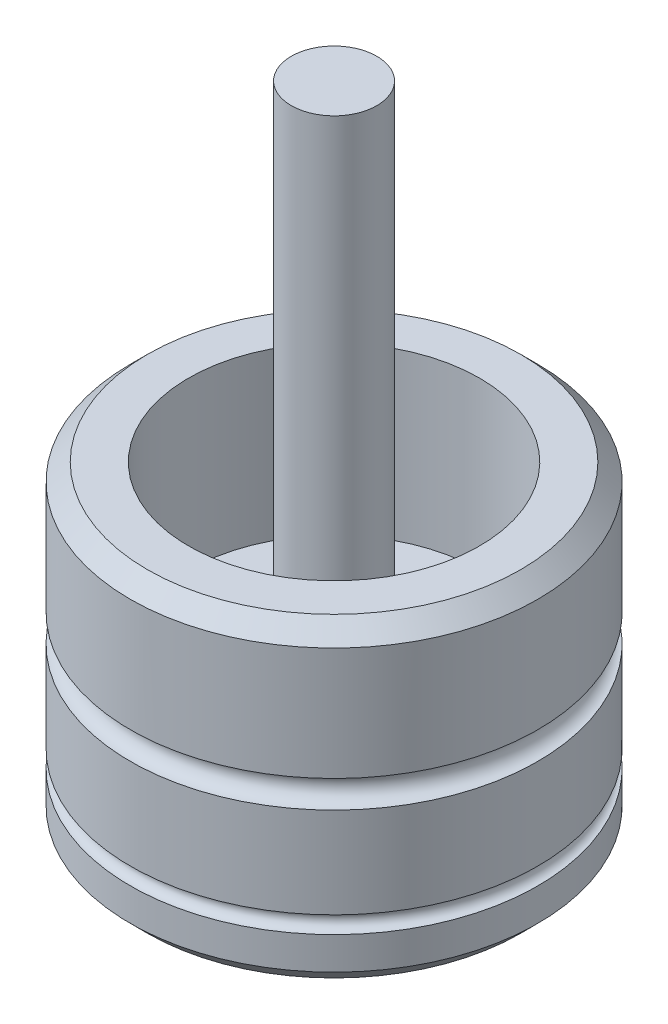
SolidWorks part; units mm, degrees
ref_plane "Front Plane" through (0, 0, 0) normal (0, 0, 1) x (1, 0, 0)
ref_plane "Top Plane" through (0, 0, 0) normal (0, 1, 0) x (1, 0, 0)
ref_plane "Right Plane" through (0, 0, 0) normal (1, 0, 0) x (0, 0, -1)
sketch "Sketch1" plane through (0, 0, 0) normal (1, 0, 0) x (0, 0, -1)
  line L0 (0, 0) -> (0, 92.5938) construction
  line L1 (0, 0) -> (15.113, 0)
  line L2 (15.113, 0) -> (15.113, 3.683)
  line L3 (15.113, 23.368) -> (10.795, 23.368)
  line L4 (10.795, 23.368) -> (10.795, 11.0265)
  line L5 (10.795, 11.0265) -> (0, 11.0265)
  line L6 (0, 11.0265) -> (0, 0)
  line L7 (15.113, 4.953) -> (15.113, 11.684)
  line L8 (15.113, 13.716) -> (15.113, 23.368)
  arc A0 (15.113, 4.953) -> (15.113, 3.683) centre (15.113, 4.318) ccw
  arc A1 (15.113, 13.716) -> (15.113, 11.684) centre (15.113, 12.7) ccw
  dimension "D5" = 4.318
  dimension "D7" = 1.27
  dimension "D8" = 2.032
  dimension "D1" = 15.113
  dimension "D2" = 23.368
  dimension "D3" = 10.795
  dimension "D6" = 12.7
revolve "Revolve1" add sketch "Sketch1" angle 360 about L0
chamfer "Chamfer1" distance 1.27 angle 45 2 edges at (0, 0, -15.113) (0, 23.368, -15.113)
sketch "Sketch2" plane through (0, 11.0265, 0) normal (0, 1, 0) x (1, 0, 0)
  circle A0 centre (0, 0) radius 3.175
  dimension "D1" = 6.35
extrude "Boss-Extrude1" add sketch "Sketch2" along normal blind 36.83
